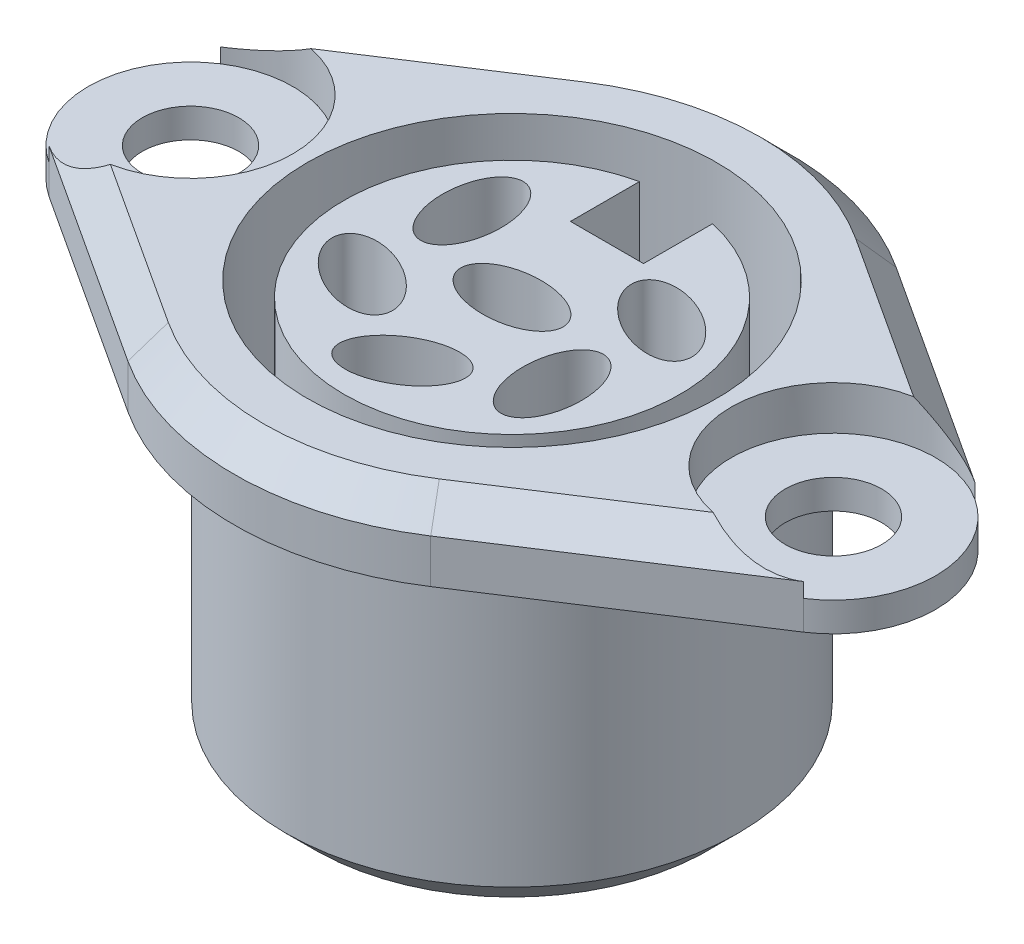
SolidWorks part; units mm, degrees
ref_plane "Plan1" through (0, 0, 0) normal (0, 0, 1) x (1, 0, 0)
ref_plane "Plan2" through (0, 0, 0) normal (0, 1, 0) x (1, 0, 0)
ref_plane "Plan3" through (0, 0, 0) normal (1, 0, 0) x (0, 0, -1)
sketch "Esquisse1" plane through (0, 0, 0) normal (0, 0, 1) x (1, 0, 0)
  line L0 (0, 25.6824) -> (0, -25.6824) construction
  line L1 (0, -12) -> (7, -12)
  line L2 (7, -12) -> (7, 0)
  line L3 (7, 0) -> (14.5, 0)
  line L4 (14.5, 0) -> (14.5, -2.5)
  line L5 (14.5, -2.5) -> (7.75, -2.5)
  line L6 (7.75, -2.5) -> (7.75, -13.5)
  line L7 (7.75, -13.5) -> (0, -13.5)
  line L8 (0, -12) -> (0, -13.5)
  dimension "D1" = 14
  dimension "D2" = 29
  dimension "D3" = 15.5
  dimension "D4" = 2.5
  dimension "D5" = 13.5
  dimension "D6" = 1.5
revolve "Base-Révolution" add sketch "Esquisse1" angle 360 about L0
sketch "Esquisse2" plane through (0, 0, 0) normal (0, 1, 0) x (-1, 0, 0)
  line L0 (-12.9091, 2.9335) -> (-5.1818, 7.9623)
  line L1 (5.1818, 7.9623) -> (12.9091, 2.9335)
  line L2 (12.9091, -2.9335) -> (5.1818, -7.9623)
  line L3 (-5.1818, -7.9623) -> (-12.9091, -2.9335)
  arc A0 (-5.1818, 7.9623) -> (5.1818, 7.9623) centre (0, 0) cw
  arc A1 (-5.1818, -7.9623) -> (5.1818, -7.9623) centre (0, 0) ccw
  arc A2 (12.9091, 2.9335) -> (12.9091, -2.9335) centre (11, 0) cw
  arc A3 (-12.9091, 2.9335) -> (-12.9091, -2.9335) centre (-11, 0) ccw
  circle A5 centre (0, 0) radius 14.5 construction
  circle A6 centre (0, 0) radius 17.5
  dimension "D1" = 19
  dimension "D2" = 3.5
  dimension "D3" = 35
extrude "Enlèv. mat.-Extru.1" cut sketch "Esquisse2" against normal through all
sketch "Esquisse3" plane through (0, 0, 0) normal (0, 1, 0) x (-1, 0, 0)
  circle A0 centre (11, 0) radius 1.65
  circle A1 centre (-11, 0) radius 1.65
  arc A2 (-12.9091, 2.9335) -> (-12.9091, -2.9335) centre (-11, 0) ccw construction
  arc A3 (12.9091, -2.9335) -> (12.9091, 2.9335) centre (11, 0) ccw construction
  dimension "D1" = 3.3
extrude "Enlèv. mat.-Extru.2" cut sketch "Esquisse3" against normal through all
chamfer "Chanfrein1" distance 1 angle 45
sketch "Esquisse4" plane through (0, 0, 0) normal (0, 1, 0) x (-1, 0, 0)
  circle A0 centre (11, 0) radius 3.5
  circle A1 centre (-11, 0) radius 3.5
  arc A2 (-12.9091, 2.9335) -> (-12.9091, -2.9335) centre (-11, 0) ccw construction
  arc A3 (12.9091, -2.9335) -> (12.9091, 2.9335) centre (11, 0) ccw construction
extrude "Enlèv. mat.-Extru.3" cut sketch "Esquisse4" against normal blind 1.5
sketch "Esquisse5" plane through (0, -12, 0) normal (0, 1, 0) x (-1, 0, 0)
  line L3 (0, 1.3147) -> (0, -1.3147) construction
  line L4 (-6.2704, 0) -> (6.2704, 0) construction
  line L5 (1.25, -3.25) -> (1.25, -5.6125)
  line L6 (-1.25, -3.25) -> (1.25, -3.25)
  line L7 (-1.25, -5.6125) -> (-1.25, -3.25)
  arc A0 (-1.25, -5.6125) -> (1.25, -5.6125) centre (0, 0) cw
  dimension "D1" = 11.5
  dimension "D2" = 9
  dimension "D3" = 2.5
extrude "Boss.-Extru.1" add sketch "Esquisse5" along normal offset from surface (11.5 mm away) 0.5
sketch "Esquisse6" plane through (0, -0.5, 0) normal (0, 1, 0) x (-1, 0, 0)
  ellipse E0 centre (0, 0) end of major axis (-1.75, 0) minor radius 1
  dimension "D1" = 2
  dimension "D2" = 3.5
extrude "Enlèv. mat.-Extru.4" cut sketch "Esquisse6" against normal through all
sketch "Esquisse7" plane through (0, -0.5, 0) normal (0, 1, 0) x (-1, 0, 0)
  line L0 (-5.1713, 0) -> (5.1713, 0) construction
  line L1 (0, 0) -> (3.2476, -1.875) construction
  circle A0 centre (0, 0) radius 3.75 construction
  ellipse E0 centre (3.2476, -1.875) end of major axis (3.2476, -3.625) minor radius 1
  dimension "D1" = 7.5
  dimension "D2" = 2
  dimension "D3" = 3.5
  dimension "D4" = 30
extrude "Enlèv. mat.-Extru.5" cut sketch "Esquisse7" against normal through all
pattern_circular "Répétition circulaire1" count 5 every 60 about axis through (0, 25.6824, 0) along (0, -1, 0)
